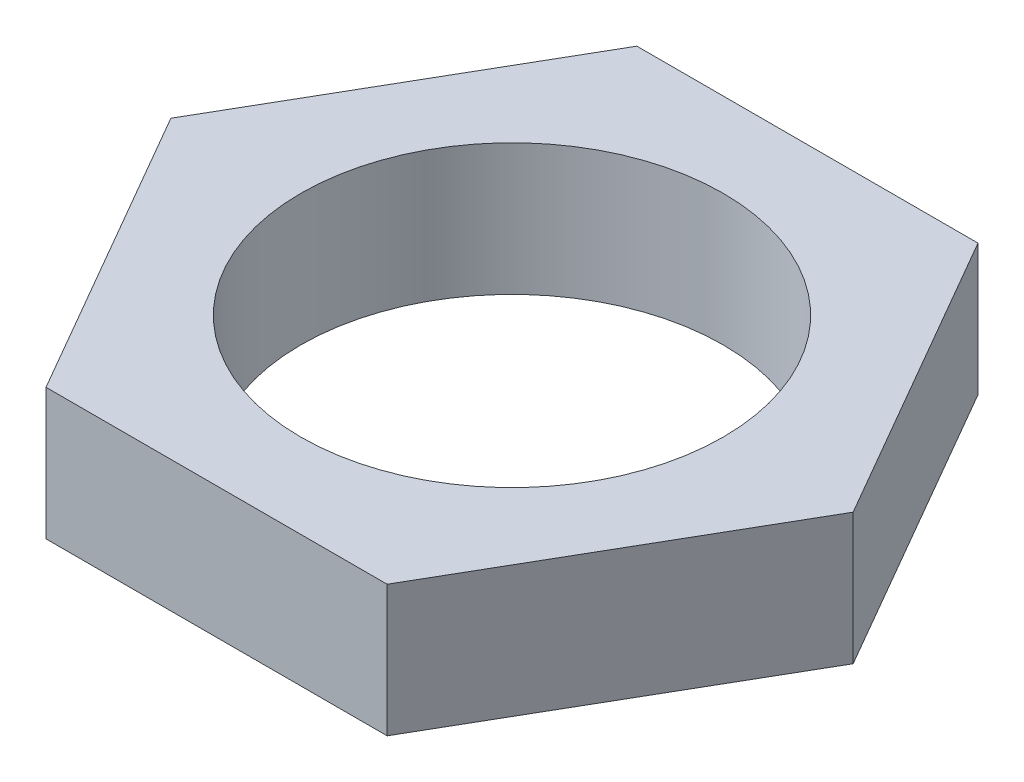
SolidWorks part; units mm, degrees
ref_plane "Plan de face" through (0, 0, 0) normal (0, 0, 1) x (1, 0, 0)
ref_plane "Plan de dessus" through (0, 0, 0) normal (0, 1, 0) x (1, 0, 0)
ref_plane "Plan de droite" through (0, 0, 0) normal (1, 0, 0) x (0, 0, -1)
sketch "Esquisse1" plane through (0, 0, 0) normal (0, 1, 0) x (1, 0, 0)
  line L1 (7.7942, -13.5) -> (15.5885, 0)
  line L2 (15.5885, 0) -> (7.7942, 13.5)
  line L3 (7.7942, 13.5) -> (-7.7942, 13.5)
  line L4 (-7.7942, 13.5) -> (-15.5885, 0)
  line L5 (-15.5885, 0) -> (-7.7942, -13.5)
  line L6 (-7.7942, -13.5) -> (7.7942, -13.5)
  circle A0 centre (0, 0) radius 13.5 construction
  circle A1 centre (0, 0) radius 9.65
  dimension "D2" = 19.3
  dimension "D1" = 27
extrude "Extrusion1" add sketch "Esquisse1" along normal blind 6
